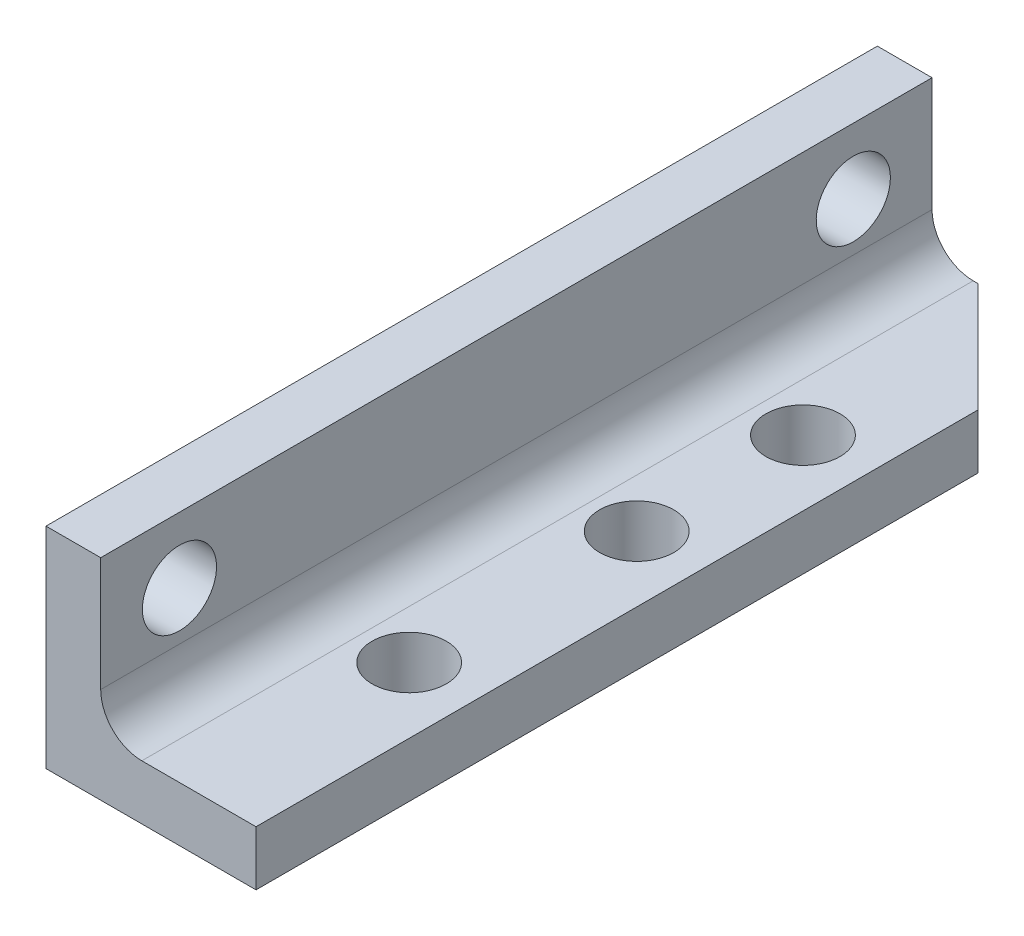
SolidWorks part; units mm, degrees
ref_plane "Front" through (0, 0, 0) normal (0, 0, 1) x (1, 0, 0)
ref_plane "Top" through (0, 0, 0) normal (0, 1, 0) x (1, 0, 0)
ref_plane "Right" through (0, 0, 0) normal (1, 0, 0) x (0, 0, -1)
sketch "Sketch1" plane through (0, 0, 0) normal (0, 0, 1) x (1, 0, 0)
  line L0 (3.175, 12.192) -> (3.175, 5.5626)
  line L1 (0, 0) -> (12.192, 0)
  line L2 (0, 0) -> (0, 12.192)
  line L3 (0, 12.192) -> (3.175, 12.192)
  line L4 (12.192, 0) -> (12.192, 3.175)
  line L5 (5.5626, 3.175) -> (12.192, 3.175)
  arc A0 (3.175, 5.5626) -> (5.5626, 3.175) centre (5.5626, 5.5626) ccw
  dimension "D1" = 2.3876
  dimension "D2" = 3.175
  dimension "D3" = 3.175
  dimension "D4" = 12.192
extrude "Extrude1" add sketch "Sketch1" along normal blind 24.13
hole_wizard "#18 (0.169500) Diameter Hole2" positions "Sketch9" profile "Sketch8" hole size "#18" standard "Ansi Inch"
sketch "Sketch9" plane through (0, 0, 0) normal (-1, 0, 0) x (0, 0, 1)
  line L0 (24.13, 12.192) -> (0, 12.192) construction
  line L1 (24.13, 12.192) -> (24.13, 0) construction
  point P0 (19.558, 8.382)
  dimension "D1" = 3.81
  dimension "D2" = 4.572
sketch "Sketch8" plane through (0, 8.382, 19.558) normal (0, 1, 0) x (0, 0, 1)
  line L0 (0, 0) -> (0, 12.192)
  line L1 (0, 12.192) -> (2.1526, 12.192)
  line L2 (2.1526, 12.192) -> (2.1526, 0)
  line L5 (2.1526, 0) -> (0, 0)
  line L11 (0, -6.35) -> (0, 107.95) construction
  dimension "Thru Hole Dia." = 4.3053
  dimension "Thru Hole Depth" = 12.192
hole_wizard "#18 (0.169500) Diameter Hole3" positions "Sketch11" profile "Sketch10" hole size "#18" standard "Ansi Inch"
sketch "Sketch11" plane through (0, 0, 0) normal (0, -1, 0) x (1, 0, 0)
  line L0 (12.192, 24.13) -> (12.192, 0) construction
  line L1 (0, 24.13) -> (12.192, 24.13) construction
  point P0 (8.382, 11.43)
  dimension "D1" = 3.81
  dimension "D2" = 12.7
sketch "Sketch10" plane through (8.382, 0, 11.43) normal (1, 0, 0) x (0, 0, -1)
  line L0 (0, 0) -> (0, 12.192)
  line L1 (0, 12.192) -> (2.1526, 12.192)
  line L2 (2.1526, 12.192) -> (2.1526, 0)
  line L5 (2.1526, 0) -> (0, 0)
  line L11 (0, -6.35) -> (0, 107.95) construction
  dimension "Thru Hole Dia." = 4.3053
  dimension "Thru Hole Depth" = 12.192
mirror "Mirror1" about plane through (5.5626, 5.5626, 0) normal (0, 0, 1)
chamfer "Chamfer1" distance 6.35 angle 45 1 edges at (12.192, 1.5875, -24.13)
hole_wizard "#18 (0.1695) Diameter Hole1" positions "Sketch13" profile "Sketch12" hole size "#18" standard "Ansi Inch"
sketch "Sketch13" plane through (0, 3.175, 0) normal (0, 1, 0) x (-1, 0, 0)
  point P0 (-8.382, -1.778)
  dimension "D1" = 13.208
sketch "Sketch12" plane through (8.382, 3.175, -1.778) normal (1, 0, 0) x (0, 0, 1)
  line L0 (0, 0) -> (0, 3.175)
  line L1 (0, 3.175) -> (2.1526, 3.175)
  line L2 (2.1526, 3.175) -> (2.1526, 0)
  line L5 (2.1526, 0) -> (0, 0)
  line L11 (0, -6.35) -> (0, 107.95) construction
  dimension "Thru Hole Dia." = 4.3053
  dimension "Thru Hole Depth" = 3.175
